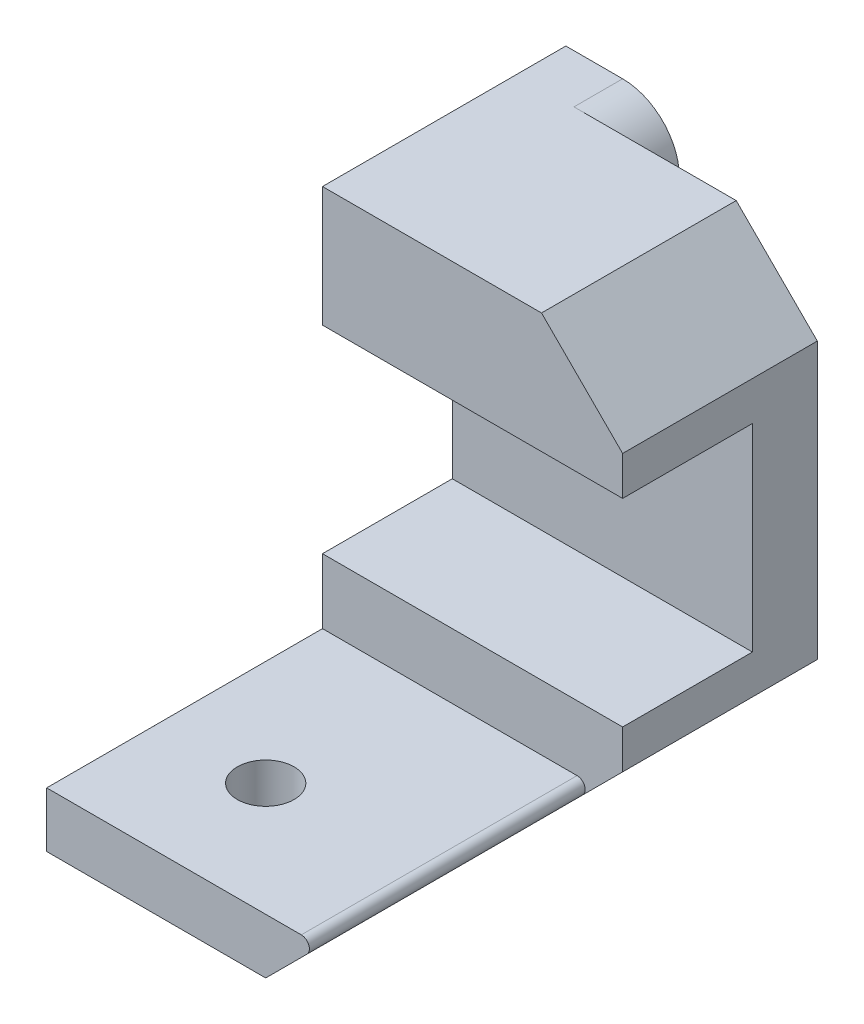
SolidWorks part; units mm, degrees
other "<100053>-<Ø3.5 (3.5) Durchmesser Bohrung2>"
ref_plane "Ebene vorne" through (0, 0, 0) normal (0, 0, 1) x (1, 0, 0)
ref_plane "Ebene oben" through (0, 0, 0) normal (0, 1, 0) x (1, 0, 0)
ref_plane "Ebene rechts" through (0, 0, 0) normal (1, 0, 0) x (0, 0, -1)
ref_plane "Ebene vorne-100053_Gespiegelt" through (0, 0, 30) normal (0, 0, -1) x (1, 0, 0)
ref_plane "Ebene oben-100053_Gespiegelt" through (0, 0, 30) normal (0, 1, 0) x (1, 0, 0)
ref_plane "Ebene rechts-100053_Gespiegelt" through (0, 0, 30) normal (1, 0, 0) x (0, 0, 1)
mirrored part "100053_Gespiegelt" parameters "D1.Aufsatz-Linear austragen1"=12, "D1.Skizze1"=18.5, "D2.Skizze1"=27, "D1.Skizze2"=8, "D2.Skizze2"=12.2, "D1.Aufsatz-Linear austragen2"=3, "D1.Skizze5"=3.5, "D2.Skizze5"=10, "D3.Skizze5"=10, "D4.Skizze5"=7, "Bohrerdurchmesser.Skizze8"=4, "Bohrungstiefe.Skizze8"=6.5, "Spitzenwinkel.Skizze8"=180, "D1.Fase1"=5, "D2.Fase1"=45, "D1.Aufsatz-Linear austragen4"=17, "D1.Skizze10"=0, "D1.Skizze11"=4, "D1.Verrundung2"=0.5, "Bohrerdurchmesser.Skizze16"=3.5, "Bohrungstiefe.Skizze16"=27, "D1.Skizze15"=7, "D2.Skizze15"=6.5
